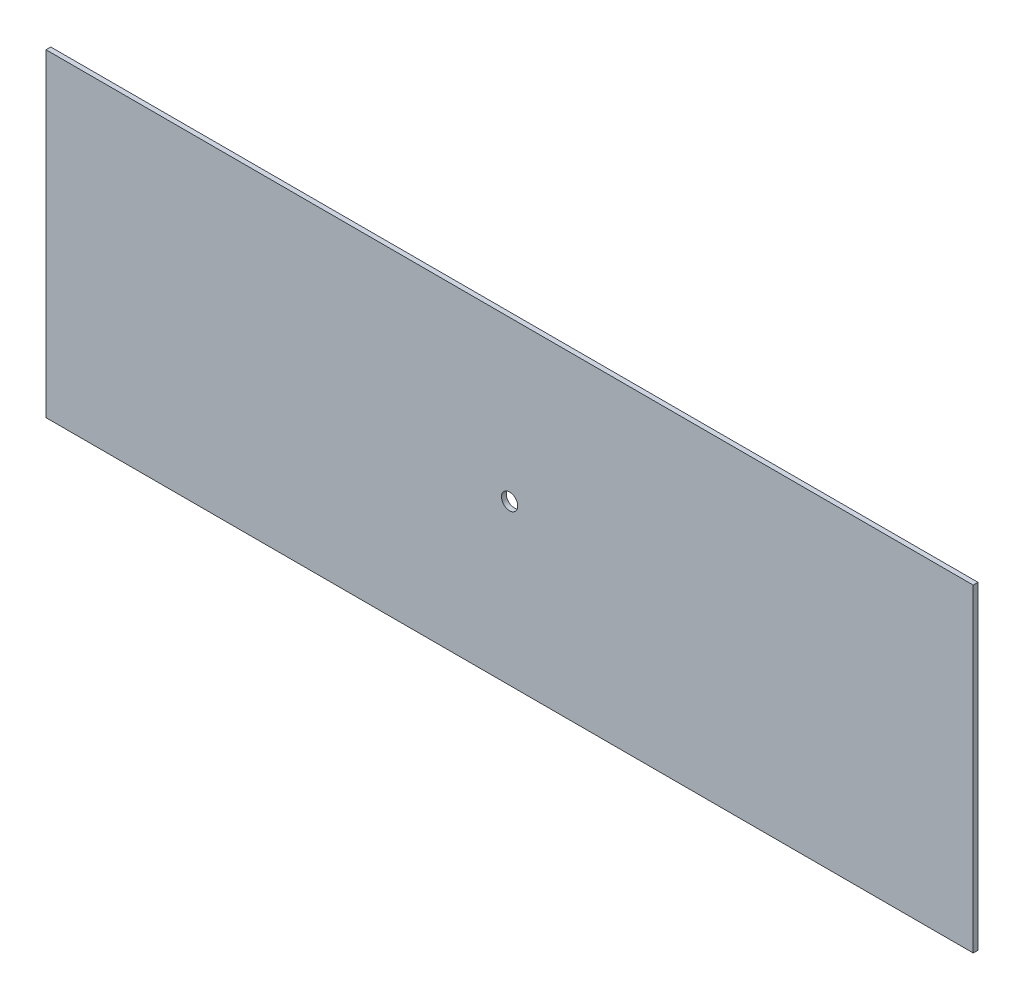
SolidWorks part; units mm, degrees
ref_plane "Front Plane" through (0, 0, 0) normal (1, 0, 0) x (0, 1, 0)
ref_plane "Top Plane" through (0, 0, 0) normal (0, 0, 1) x (0, 1, 0)
ref_plane "Right Plane" through (0, 0, 0) normal (0, 1, 0) x (-1, 0, 0)
sketch "Sketch1" plane through (0, 0, 0) normal (1, 0, 0) x (0, 1, 0)
  line L1 (-78.5622, -78.5622) -> (78.5622, -78.5622)
  line L2 (-78.5622, -78.5622) -> (-78.5622, -76.2)
  line L3 (-78.5622, -76.2) -> (78.5622, -76.2)
  line L4 (78.5622, -78.5622) -> (78.5622, -76.2)
extrude "Panel_or_block" add sketch "Sketch1" along normal blind 457.2
sketch "Sketch2" plane through (0, 0, 0) normal (0, 0, 1) x (0, 1, 0)
  circle A0 centre (0, 0) radius 4
sketch "Sketch3" plane through (0, 0, 0) normal (0, 0, 1) x (0, 1, 0)
  circle A0 centre (0, -228.6) radius 4
sketch "Sketch4" plane through (0, 0, 0) normal (0, 0, 1) x (0, 1, 0)
  circle A0 centre (0, -228.6) radius 4
extrude "Rod_clearance_8mm" cut sketch "Sketch4" against normal through all and the other way through all
